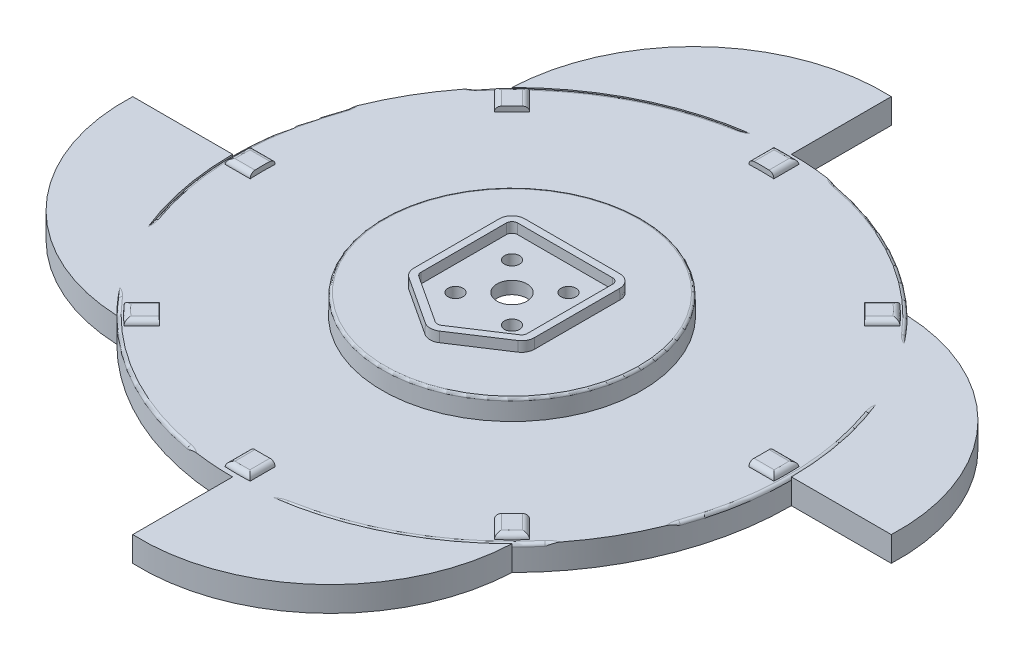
SolidWorks part; units mm, degrees
other "Solido1"
ref_plane "前视基准面" through (0, 0, 0) normal (0, 0, 1) x (1, 0, 0)
ref_plane "上视基准面" through (0, 0, 0) normal (0, 1, 0) x (1, 0, 0)
ref_plane "右视基准面" through (0, 0, 0) normal (1, 0, 0) x (0, 0, -1)
imported_body "Imported1"
sketch "Sketch1" plane through (0, 3, 0) normal (0, 1, 0) x (1, 0, 0)
  circle A0 centre (0, 0) radius 55.9579
  circle A1 centre (0, 0) radius 70.9273
extrude "Cut-Extrude1" cut sketch "Sketch1" against normal through all
sketch "Sketch2" plane through (0, 3, 0) normal (0, 1, 0) x (1, 0, 0)
  line L0 (0, 75.9579) -> (0, 55.9579)
  line L1 (0, 0) -> (-39.5682, 39.5682) construction
  line L2 (0, 55.9579) -> (0, -55.9579) construction
  line L3 (55.9579, 0) -> (-55.9579, 0) construction
  line L4 (75.9579, 0) -> (55.9579, 0)
  line L5 (0, -55.9579) -> (0, 55.9579) construction
  line L6 (0, -75.9579) -> (0, -55.9579)
  line L7 (-55.9579, 0) -> (55.9579, 0) construction
  line L8 (-75.9579, 0) -> (-55.9579, 0)
  arc A0 (7.7178, 55.4232) -> (-7.7177, 55.4232) centre (0, 0) ccw construction
  arc A1 (-9.8846, 55.078) -> (-42.7566, 36.0993) centre (0, 0) ccw construction
  arc A2 (-39.5682, 39.5682) -> (0, 75.9579) centre (-1.5893, 37.979) cw
  arc A3 (-7.7177, 55.4232) -> (-9.8846, 55.078) centre (0, 0) ccw construction
  arc A4 (7.7178, 55.4232) -> (-7.7177, 55.4232) centre (0, 0) ccw
  arc A5 (-7.7177, 55.4232) -> (-9.8846, 55.078) centre (0, 0) ccw
  arc A6 (-9.8846, 55.078) -> (-42.7566, 36.0993) centre (0, 0) ccw
  circle A7 centre (0, 0) radius 55.9579
  arc A8 (39.5682, 39.5682) -> (75.9579, 0) centre (37.979, 1.5893) cw
  arc A9 (39.5682, -39.5682) -> (0, -75.9579) centre (1.5893, -37.979) cw
  arc A10 (-39.5682, -39.5682) -> (-75.9579, 0) centre (-37.979, -1.5893) cw
  point P33 (0, 0)
  dimension "D1" = 20
  dimension "D2" = 4
extrude "Boss-Extrude1" add sketch "Sketch2" against normal blind 5 contours A6 A5 A4 L0 A2 | A8 A7 L4 | A9 A7 L6 | A10 A7 L8
other "DeleteFace2"
sketch "Sketch3" plane through (0, 0, 0) normal (0, -1, 0) x (1, 0, 0)
  circle A0 centre (0, 0) radius 55.9579
  circle A1 centre (0, 0) radius 23
extrude "Boss-Extrude2" add sketch "Sketch3" along normal up to surface (2 mm away)
